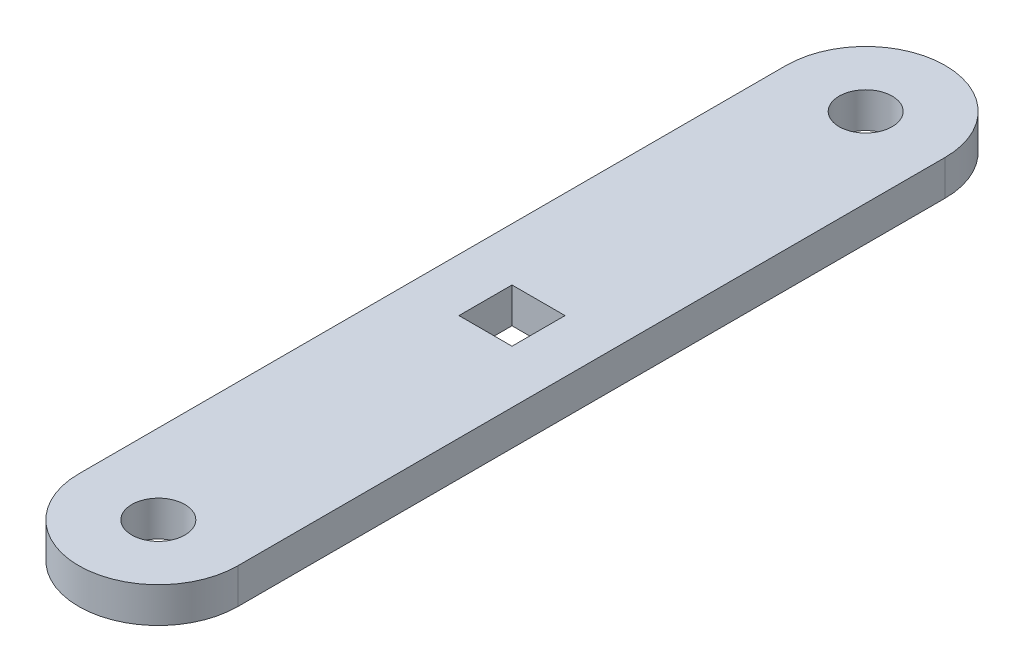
SolidWorks part; units mm, degrees
ref_plane "Front Plane" through (0, 0, 0) normal (0, 0, 1) x (1, 0, 0)
ref_plane "Top Plane" through (0, 0, 0) normal (0, 1, 0) x (1, 0, 0)
ref_plane "Right Plane" through (0, 0, 0) normal (1, 0, 0) x (0, 0, -1)
sketch "Sketch1" plane through (0, 0, 0) normal (0, 1, 0) x (1, 0, 0)
  line L1 (-225, -1000) -> (225, -1000)
  line L2 (-225, -1000) -> (-225, 1000)
  line L3 (-225, 1000) -> (225, 1000)
  line L4 (225, -1000) -> (225, 1000)
  line L5 (-225, -1000) -> (225, 1000) construction
  line L6 (-225, 1000) -> (225, -1000) construction
  arc A0 (225, -1000) -> (-225, -1000) centre (0, -1000) cw
  arc A1 (225, 1000) -> (-225, 1000) centre (0, 1000) ccw
  point P0 (0, 0)
  dimension "D1" = 2000
  dimension "D2" = 450
extrude "Boss-Extrude1" add sketch "Sketch1" along normal blind 100 contours L1 L4 L3 L2 | L3 A1 | A0 L1
sketch "Sketch2" plane through (0, 100, 0) normal (0, 1, 0) x (1, 0, 0)
  line L0 (-225, -1000) -> (225, -1000)
  line L1 (-225, -1000) -> (-225, 1000) construction
  circle A0 centre (0, -1000) radius 75
sketch "Sketch3" plane through (0, 100, 0) normal (0, 1, 0) x (1, 0, 0)
  line L0 (-225, 1000) -> (225, 1000)
  circle A0 centre (0, 1000) radius 75
extrude "Cut-Extrude2" cut sketch "Sketch3" against normal blind 250 contours L0 A0 | L0 A0
extrude "Cut-Extrude4" cut sketch "Sketch2" against normal through all contours L0 A0 | L0 A0
sketch "Sketch4" plane through (0, 100, 0) normal (0, 1, 0) x (1, 0, 0)
  line L1 (-75, -75) -> (75, -75)
  line L2 (-75, -75) -> (-75, 75)
  line L3 (-75, 75) -> (75, 75)
  line L4 (75, -75) -> (75, 75)
  line L5 (-75, -75) -> (75, 75) construction
  line L6 (-75, 75) -> (75, -75) construction
  point P0 (0, 0)
  dimension "D1" = 150
  dimension "D2" = 150
extrude "Cut-Extrude5" cut sketch "Sketch4" against normal through all
